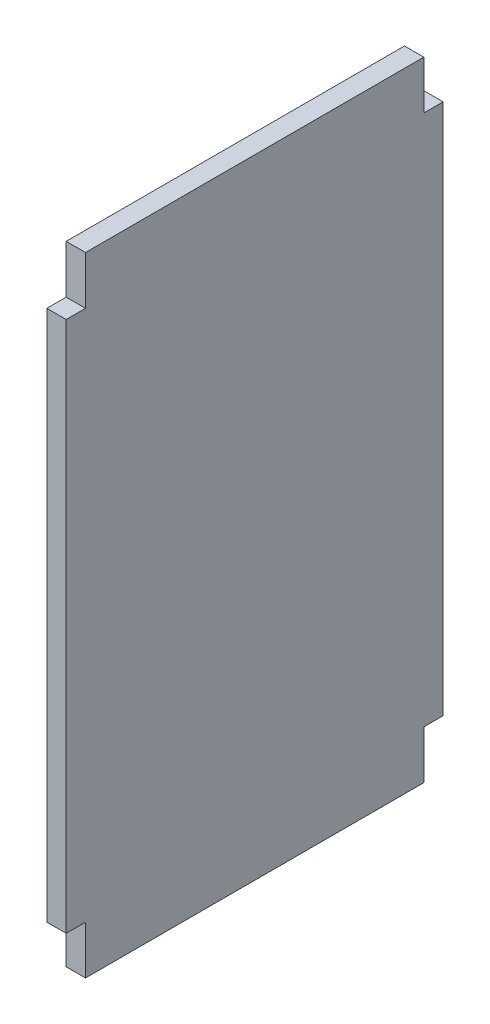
SolidWorks part; units mm, degrees
ref_plane "Front" through (0, 0, 0) normal (0, 0, 1) x (1, 0, 0)
ref_plane "Top" through (0, 0, 0) normal (0, 1, 0) x (1, 0, 0)
ref_plane "Right" through (0, 0, 0) normal (1, 0, 0) x (0, 0, -1)
sketch "草图1" plane through (0, 0, 0) normal (1, 0, 0) x (0, 0, -1)
  line L1 (0, 0) -> (35, 0)
  line L2 (0, 0) -> (0, 65)
  line L3 (0, 65) -> (35, 65)
  line L4 (35, 0) -> (35, 65)
  line L5 (0, 60) -> (-2, 60)
  line L6 (0, 60) -> (0, 5)
  line L7 (0, 5) -> (-2, 5)
  line L8 (-2, 60) -> (-2, 5)
  line L9 (35, 60) -> (37, 60)
  line L10 (35, 60) -> (35, 5)
  line L11 (35, 5) -> (37, 5)
  line L12 (37, 60) -> (37, 5)
  dimension "D1" = 65
  dimension "D2" = 35
  dimension "D3" = 55
  dimension "D4" = 5
  dimension "D5" = 2
  dimension "D6" = 2
  dimension "D7" = 55
  dimension "D8" = 5
extrude "凸台-拉伸1" add sketch "草图1" along normal blind 2 contours L1 L4 L3 L2 | L5 L8 L7 L2 | L12 L9 L4 L11
